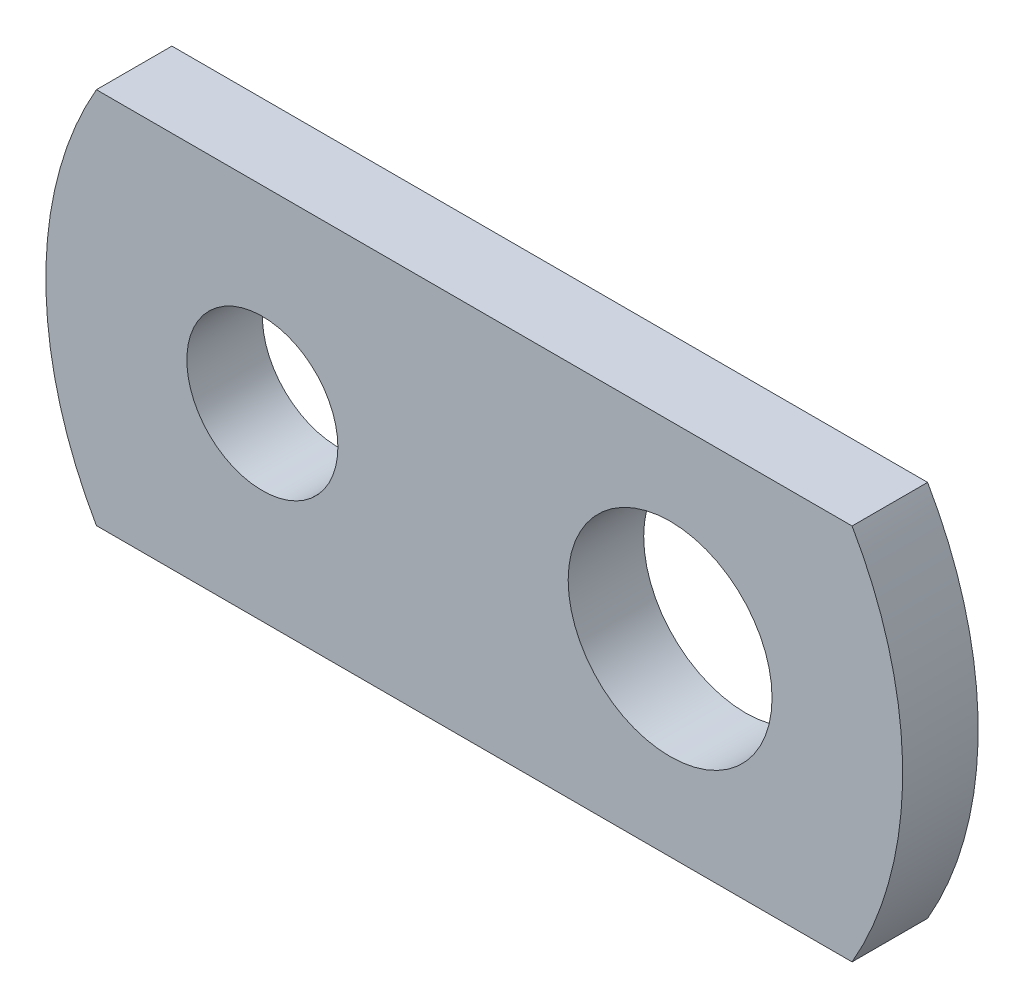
SolidWorks part; units mm, degrees
ref_plane "Plan de face" through (0, 0, 0) normal (0, 0, 1) x (1, 0, 0)
ref_plane "Plan de dessus" through (0, 0, 0) normal (0, 1, 0) x (1, 0, 0)
ref_plane "Plan de droite" through (0, 0, 0) normal (1, 0, 0) x (0, 0, -1)
sketch "Esquisse1" plane through (0, 0, 0) normal (0, 0, 1) x (1, 0, 0)
  line L0 (55.6772, 3.696) -> (55.6772, -60.8538) construction
  line L1 (6.6987, 0) -> (106.7766, 0)
  line L3 (6.6987, -50) -> (106.7766, -50)
  line L5 (7.1606, -25) -> (109.5099, -25) construction
  circle A0 centre (82.6772, -25) radius 13.5
  circle A1 centre (28.6772, -25) radius 10
  arc A2 (6.6987, 0) -> (6.6987, -50) centre (50, -25) ccw
  arc A3 (106.7766, -50) -> (106.7766, 0) centre (63.4753, -25) ccw
  dimension "D3" = 27
  dimension "D5" = 20
  dimension "D7" = 100
  dimension "D1" = 100
  dimension "D4" = 27
  dimension "D6" = 27
extrude "Extrusion1" add sketch "Esquisse1" along normal blind 10
